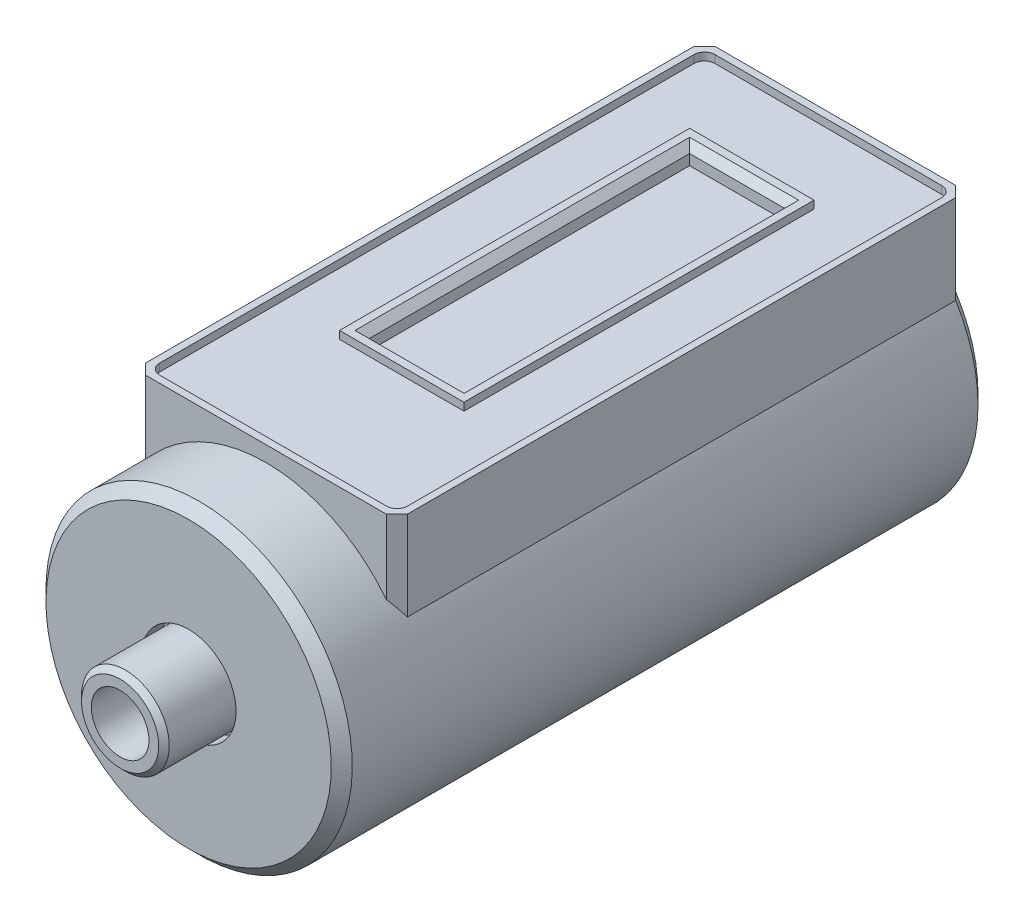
SolidWorks part; units mm, degrees
ref_plane "Front" through (0, 0, 0) normal (0, 0, 1) x (1, 0, 0)
ref_plane "Top" through (0, 0, 0) normal (0, 1, 0) x (1, 0, 0)
ref_plane "Right" through (0, 0, 0) normal (1, 0, 0) x (0, 0, -1)
sketch "Sketch2" plane through (0, 0, 0) normal (1, 0, 0) x (0, 0, -1)
  line L0 (161.035, 0) -> (161.035, 2.79)
  line L1 (161.415, 3.17) -> (167.255, 3.17)
  line L2 (165.985, 3.43) -> (165.985, 10.31)
  line L3 (166.745, 11.07) -> (212.725, 11.07)
  line L4 (212.725, 11.07) -> (212.725, 0)
  line L5 (212.725, 0) -> (161.035, 0)
  line L6 (165.985, 3.43) -> (167.255, 3.43)
  line L7 (167.255, 3.43) -> (167.255, 3.17)
  line L8 (161.035, 2.79) -> (161.415, 3.17)
  line L9 (165.985, 10.31) -> (166.745, 11.07)
  point P5 (0, 0)
  point P12 (18.4159, 5.7475)
  dimension "D1" = 51.69
  dimension "D2" = 3.17
  dimension "D3" = 11.07
  dimension "D4" = 4.95
  dimension "D5" = 1.27
  dimension "D6" = 3.43
  dimension "D7" = 2.79
  dimension "D8" = 0.38
  dimension "D9" = 0.76
  dimension "D10" = 10.31
  dimension "D11" = 212.725
revolve "Revolve1" add sketch "Sketch2" angle 360 about L5
sketch "Sketch3" plane through (0, 0, 0) normal (0, 1, 0) x (1, 0, 0)
  line L0 (11.07, 212.725) -> (-11.07, 212.725) construction
  line L1 (-9.46, 212.725) -> (9.46, 212.725)
  line L2 (-9.46, 212.725) -> (-9.46, 172.335)
  line L3 (-8.7, 171.575) -> (8.7, 171.575)
  line L4 (9.46, 212.725) -> (9.46, 172.335)
  line L5 (-9.46, 172.335) -> (-8.7, 171.575)
  line L6 (9.46, 172.335) -> (8.7, 171.575)
  point P1 (9.46, 171.575)
  point P2 (-9.46, 171.575)
  point P6 (0, 171.575)
  dimension "D1" = 41.15
  dimension "D2" = 18.92
extrude "Extrude1" add sketch "Sketch3" along normal blind 12.19
chamfer "Chamfer1" distance 0.76 angle 45 3 edges at (-9.46, 8.9696, -212.725) (0, -11.07, -212.725) (9.46, 8.9696, -212.725)
sketch "Sketch4" plane through (0, 12.19, 0) normal (0, 1, 0) x (1, 0, 0)
  line L0 (-8.7, 171.575) -> (8.7, 171.575) construction
  line L1 (-8.19, 212.215) -> (8.2, 212.215)
  line L2 (-8.95, 211.455) -> (-8.95, 172.845)
  line L3 (-8.19, 172.085) -> (8.2, 172.085)
  line L4 (8.96, 211.455) -> (8.96, 172.845)
  line L5 (-9.46, 172.335) -> (-9.46, 211.965) construction
  line L7 (-4.49, 206.685) -> (4.5, 206.685)
  line L8 (-4.49, 206.685) -> (-4.49, 181.385)
  line L9 (-4.49, 181.385) -> (4.5, 181.385)
  line L10 (4.5, 206.685) -> (4.5, 181.385)
  arc A0 (-8.95, 211.455) -> (-8.19, 212.215) centre (-8.19, 211.455) cw
  arc A1 (8.96, 211.455) -> (8.2, 212.215) centre (8.2, 211.455) ccw
  arc A2 (8.96, 172.845) -> (8.2, 172.085) centre (8.2, 172.845) cw
  arc A3 (-8.95, 172.845) -> (-8.19, 172.085) centre (-8.19, 172.845) ccw
  dimension "D5" = 0.76
  dimension "D1" = 17.91
  dimension "D2" = 40.13
  dimension "D3" = 0.51
  dimension "D4" = 0.51
  dimension "D6" = 5.53
  dimension "D7" = 4.46
  dimension "D8" = 4.46
  dimension "D9" = 25.3
extrude "Cut-Extrude1" cut sketch "Sketch4" against normal blind 0.56
sketch "Sketch5" plane through (0, 12.19, 0) normal (0, 1, 0) x (1, 0, 0)
  line L1 (-3.42, 205.615) -> (3.44, 205.615)
  line L2 (-3.42, 205.615) -> (-3.42, 182.455)
  line L3 (-3.42, 182.455) -> (3.44, 182.455)
  line L4 (3.44, 205.615) -> (3.44, 182.455)
  line L6 (4.5, 206.685) -> (-4.49, 206.685) construction
  line L7 (-4.49, 206.685) -> (-4.49, 181.385) construction
  point P4 (0.005, 206.685)
  dimension "D1" = 6.86
  dimension "D2" = 23.16
  dimension "D3" = 1.07
  dimension "D4" = 1.07
extrude "Cut-Extrude2" cut sketch "Sketch5" against normal blind 1.27
chamfer "Chamfer2" distance 0.51 angle 45 4 edges at (0.01, 12.19, -182.455) (3.44, 12.19, -194.035) (-3.42, 12.19, -194.035) (0.01, 12.19, -205.615)
hole_wizard "Hole1" positions "Sketch7" profile "Sketch6" legacy
sketch "Sketch7" plane through (0, 0, -161.035) normal (0, 0, 1) x (1, 0, 0)
  circle A0 centre (0, 0) radius 3.17 construction
  point P0 (0, 0)
sketch "Sketch6" plane through (0, 0, -161.035) normal (1, 0, 0) x (0, -1, 0)
  line L0 (0, 0) -> (0, 7.6015)
  line L1 (0, 7.6015) -> (2.0828, 6.35)
  line L2 (2.0828, 6.35) -> (2.0828, 0)
  line L4 (2.0828, 0) -> (0, 0)
  line L6 (0, 7.6015) -> (-2.0828, 6.35) construction
  line L7 (0, -4.2442) -> (0, 117.3081) construction
  dimension "Diameter" = 4.1656
  dimension "Depth" = 6.35
  dimension "Drill Angle" = 118
